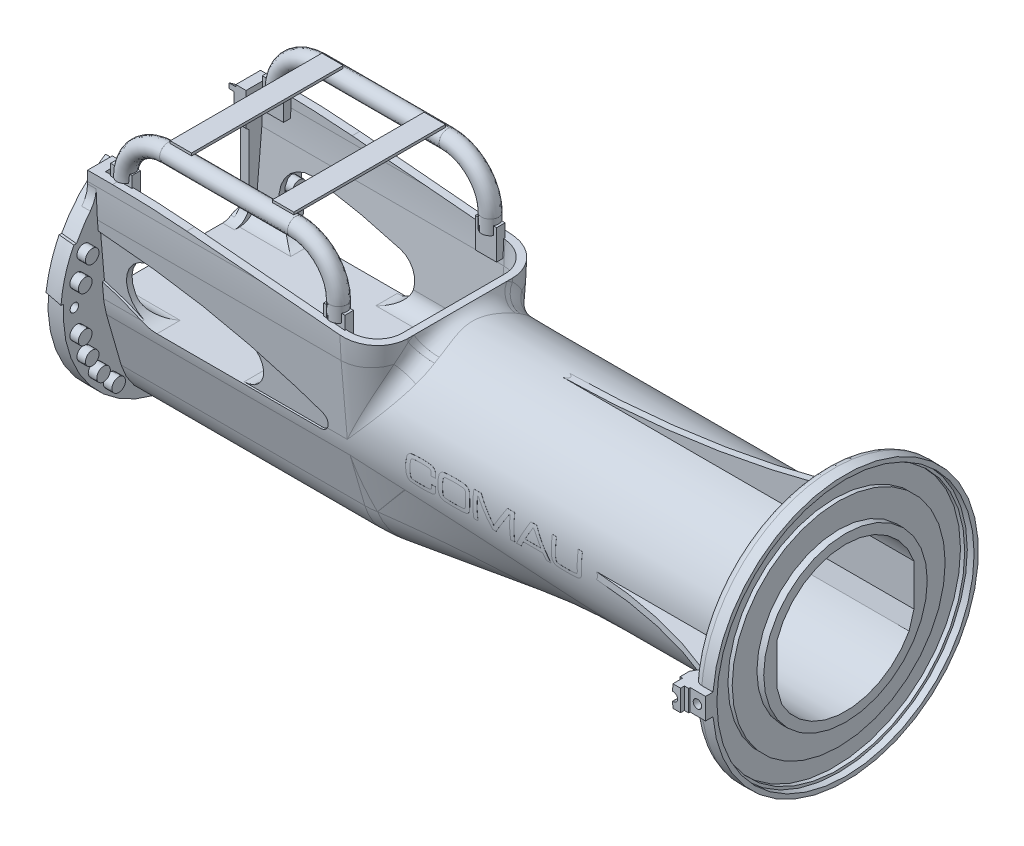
SolidWorks part; units mm, degrees
ref_plane "Piano1 (Front/Back)" through (0, 0, 0) normal (0, 0, 1) x (1, 0, 0)
ref_plane "Piano2 (Top/Bottom)" through (0, 0, 0) normal (0, 1, 0) x (1, 0, 0)
ref_plane "Piano3 (Left/Right)" through (0, 0, 0) normal (1, 0, 0) x (0, 0, -1)
imported_body "Importato1"
sketch "Schizzo1" plane through (0, 0, -80.326) normal (0, 0, 1) x (1, 0, 0)
  line L0 (-207, -15) -> (-417, -15) construction
  line L1 (8, -12.5) -> (8, 12.5) construction
  line L2 (8, -156) -> (8, 156) construction
  text T0 "COMAU" font "MicrogrammaDMedExt" height 30
  point P2 (8, 0)
  point P5 (-312, -15)
  dimension "D1" = 15
  dimension "D2" = 210
  dimension "D3" = 320
extrude "Estrusione1" add sketch "Schizzo1" against normal offset from surface (12.1736 mm away) 0.1
sketch "Schizzo2" plane through (0, 0, 80.326) normal (0, 0, -1) x (-1, 0, 0)
  line L0 (417, -15) -> (207, -15) construction
  text T0 "COMAU" font "MicrogrammaDMedExt" height 30
  point P2 (312, -15)
  dimension "D1" = 15
  dimension "D2" = 210
  dimension "D3" = 320
extrude "Estrusione2" add sketch "Schizzo2" against normal offset from surface (12.1736 mm away) 0.1
